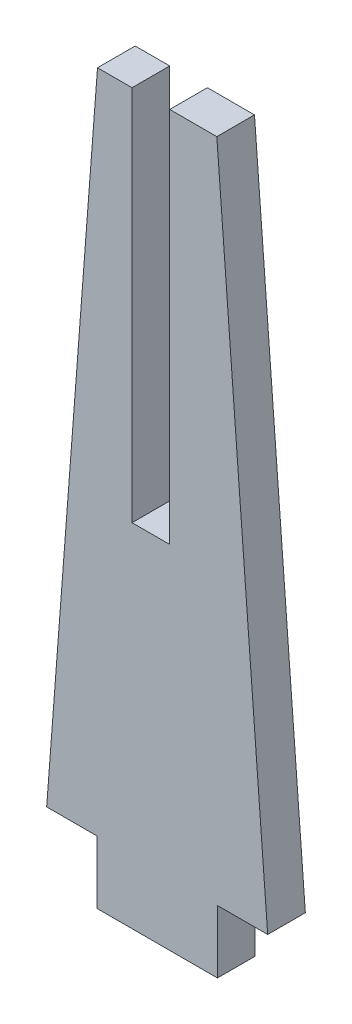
SolidWorks part; units mm, degrees
ref_plane "Alzado" through (0, 0, 0) normal (0, 0, 1) x (1, 0, 0)
ref_plane "Planta" through (0, 0, 0) normal (0, 1, 0) x (1, 0, 0)
ref_plane "Vista lateral" through (0, 0, 0) normal (1, 0, 0) x (0, 0, -1)
sketch "Sketch1" plane through (0, 0, 0) normal (0, 0, 1) x (1, 0, 0)
  line L0 (4.8, 2.5) -> (8.8, 2.5)
  line L1 (-4.8, -2.5) -> (4.8, -2.5)
  line L2 (-4.8, -2.5) -> (-4.8, 2.5)
  line L3 (-4.8, 2.5) -> (4.8, 2.5)
  line L4 (4.8, -2.5) -> (4.8, 2.5)
  line L5 (-4.8, -2.5) -> (4.8, 2.5) construction
  line L6 (-4.8, 2.5) -> (4.8, -2.5) construction
  line L7 (-4.8, 2.5) -> (-8.8, 2.5)
  line L8 (1, 55.5) -> (4.75, 55.5)
  line L9 (-4.75, 55.5) -> (-2, 55.5)
  line L10 (4.75, 55.5) -> (8.8, 2.5)
  line L11 (-4.75, 55.5) -> (-8.8, 2.5)
  line L12 (-2, 25.5) -> (1, 25.5)
  line L13 (-2, 25.5) -> (-2, 55.5)
  line L14 (1, 25.5) -> (1, 55.5)
  point P0 (0, 0)
  point P13 (0, 55.5)
  point P16 (-0.5, 25.5)
  dimension "D1" = 9.6
  dimension "D2" = 5
  dimension "D3" = 4
  dimension "D4" = 4
  dimension "D5" = 53
  dimension "D6" = 9.5
  dimension "D7" = 9.4724
  dimension "D8" = 30
  dimension "D9" = 3
  dimension "D10" = 54.0892
extrude "Boss-Extrude1" add sketch "Sketch1" along normal blind 3 contours L14 L12 L13 L9 L11 L7 L3 L0 L10 L8 | L1 L4 L3 L2
sketch "Sketch2" plane through (0, 0, 3) normal (0, 0, 1) x (1, 0, 0)
